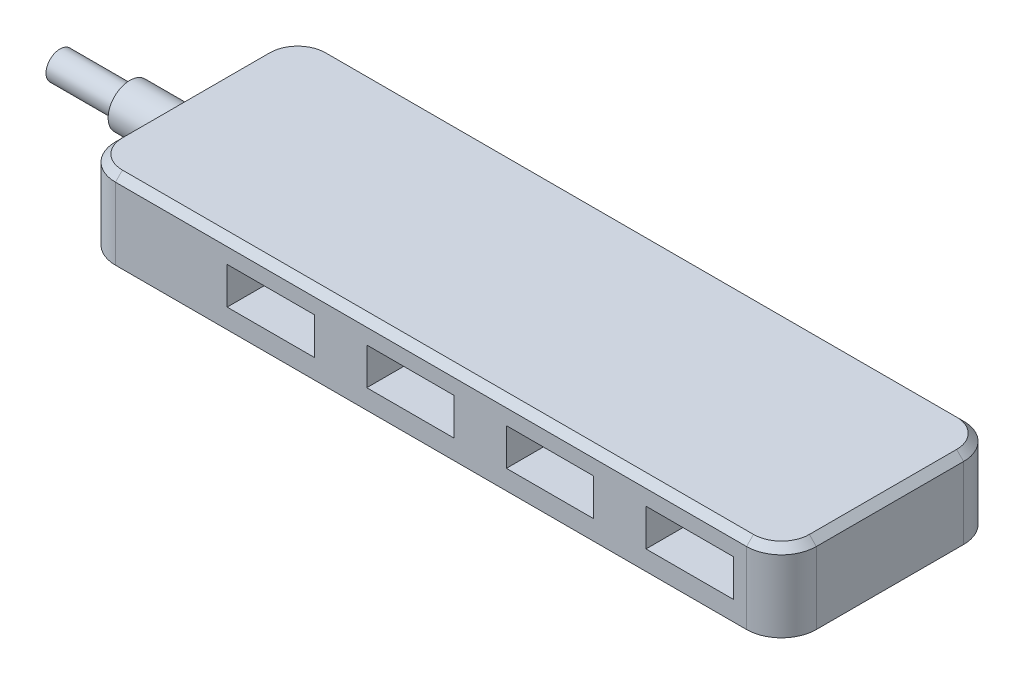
SolidWorks part; units mm, degrees
ref_plane "Alzado" through (0, 0, 0) normal (0, 0, 1) x (1, 0, 0)
ref_plane "Planta" through (0, 0, 0) normal (0, 1, 0) x (1, 0, 0)
ref_plane "Vista lateral" through (0, 0, 0) normal (1, 0, 0) x (0, 0, -1)
sketch "Croquis1" plane through (0, 0, 0) normal (0, 1, 0) x (1, 0, 0)
  line L1 (-50.2, -15.55) -> (50.2, -15.55)
  line L2 (-50.2, -15.55) -> (-50.2, 15.55)
  line L3 (-50.2, 15.55) -> (50.2, 15.55)
  line L4 (50.2, -15.55) -> (50.2, 15.55)
  line L5 (-50.2, -15.55) -> (50.2, 15.55) construction
  line L6 (-50.2, 15.55) -> (50.2, -15.55) construction
  point P0 (0, 0)
  dimension "D1" = 31.1
  dimension "D2" = 100.4
extrude "Saliente-Extruir1" add sketch "Croquis1" along normal blind 11.3
fillet "Redondeo1" radius 5 4 edges at (-50.2, 5.65, 15.55) (-50.2, 5.65, -15.55) (50.2, 5.65, -15.55) (50.2, 5.65, 15.55)
chamfer "Chaflán1" distance 1 angle 45 8 edges at (-48.7355, 11.3, -14.0855) (0, 11.3, -15.55) (48.7355, 11.3, -14.0855) (50.2, 11.3, 0) (48.7355, 11.3, 14.0855) (0, 11.3, 15.55) (-48.7355, 11.3, 14.0855) (-50.2, 11.3, 0)
sketch "Croquis2" plane through (0, 0, 15.55) normal (0, 0, 1) x (1, 0, 0)
  line L1 (-29.2, 2.8) -> (-16.7, 2.8)
  line L2 (-29.2, 2.8) -> (-29.2, 8.1)
  line L3 (-29.2, 8.1) -> (-16.7, 8.1)
  line L4 (-16.7, 2.8) -> (-16.7, 8.1)
  line L5 (-29.2, 2.8) -> (-16.7, 8.1) construction
  line L6 (-29.2, 8.1) -> (-16.7, 2.8) construction
  line L7 (-45.2, 0) -> (45.2, 0) construction
  line L8 (-50.2, 0) -> (-50.2, 10.3) construction
  line L9 (-9.2, 2.8) -> (-9.2, 8.1)
  line L10 (-9.2, 2.8) -> (3.3, 2.8)
  line L11 (3.3, 2.8) -> (3.3, 8.1)
  line L12 (-9.2, 8.1) -> (3.3, 8.1)
  line L13 (10.8, 2.8) -> (10.8, 8.1)
  line L14 (10.8, 2.8) -> (23.3, 2.8)
  line L15 (23.3, 2.8) -> (23.3, 8.1)
  line L16 (10.8, 8.1) -> (23.3, 8.1)
  line L17 (30.8, 2.8) -> (30.8, 8.1)
  line L18 (30.8, 2.8) -> (43.3, 2.8)
  line L19 (43.3, 2.8) -> (43.3, 8.1)
  line L20 (30.8, 8.1) -> (43.3, 8.1)
  point P0 (-22.95, 5.45)
  point P10 (-16.7, 5.45)
  dimension "D1" = 12.5
  dimension "D2" = 5.3
  dimension "D3" = 2.8
  dimension "D4" = 21
  dimension "D6" = 7.5
  dimension "D5" = 4
extrude "Cortar-Extruir1" cut sketch "Croquis2" against normal blind 13
sketch "Croquis3" plane through (-50.2, 0, 0) normal (-1, 0, 0) x (0, 0, 1)
  line L0 (-10.55, 0) -> (10.55, 0) construction
  circle A0 centre (0, 5.3) radius 3.1
  dimension "D1" = 6.2
  dimension "D2" = 5.3
extrude "Saliente-Extruir2" add sketch "Croquis3" along normal blind 8.5
sketch "Croquis4" plane through (-58.7, 0, 0) normal (-1, 0, 0) x (0, 0, 1)
  circle A0 centre (0, 5.3) radius 2
  dimension "D1" = 4
extrude "Saliente-Extruir3" add sketch "Croquis4" along normal blind 10
